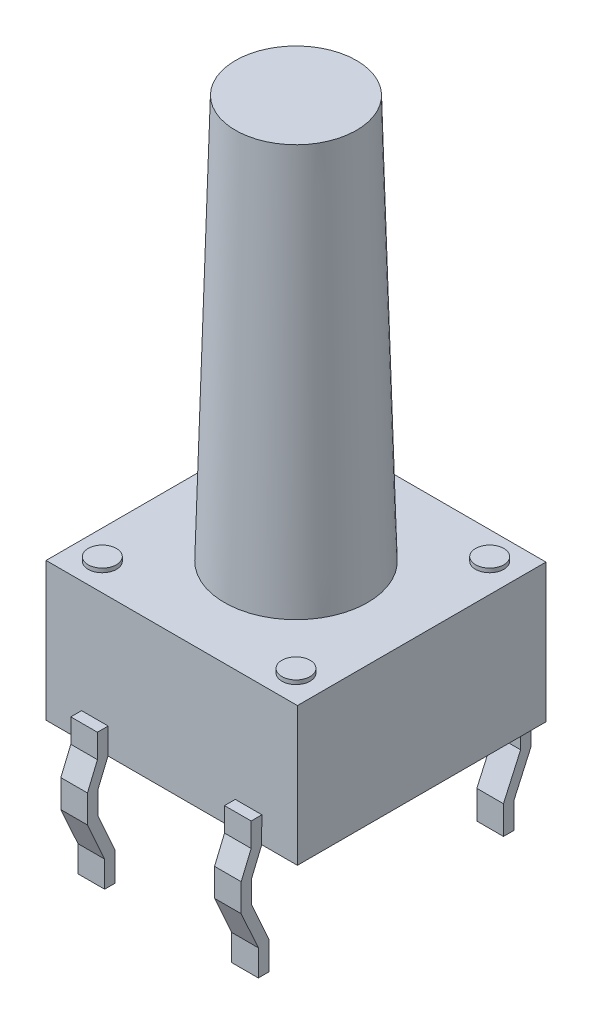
SolidWorks part; units mm, degrees
ref_plane "Plan de face" through (0, 0, 0) normal (0, 0, 1) x (1, 0, 0)
ref_plane "Plan de dessus" through (0, 0, 0) normal (0, 1, 0) x (1, 0, 0)
ref_plane "Plan de droite" through (0, 0, 0) normal (1, 0, 0) x (0, 0, -1)
sketch "Esquisse1" plane through (0, 0, 0) normal (0, 1, 0) x (1, 0, 0)
  line L0 (0, 0) -> (0, 3.08) construction
  line L1 (-3.115, -3.08) -> (3.115, -3.08)
  line L2 (-3.115, -3.08) -> (-3.115, 3.08)
  line L3 (-3.115, 3.08) -> (3.115, 3.08)
  line L4 (3.115, -3.08) -> (3.115, 3.08)
  line L5 (0, 3.08) -> (3.115, 0) construction
  line L6 (3.115, 0) -> (0, 0) construction
  dimension "D1" = 6.23
  dimension "D2" = 6.16
extrude "Extrusion1" add sketch "Esquisse1" along normal blind 3.43
sketch "Esquisse3" plane through (0, 0, 3.08) normal (0, 0, 1) x (1, 0, 0)
  line L0 (0, -1.7296) -> (0, 2.2567) construction
  line L1 (1.575, 0.6459) -> (2.235, 0.6459)
  line L2 (1.575, 0.6459) -> (1.575, 0.3844)
  line L3 (1.575, 0.3844) -> (2.235, 0.3844)
  line L4 (2.235, 0.6459) -> (2.235, 0.3844)
  line L5 (1.905, 2.2567) -> (1.905, -1.7296) construction
  line L6 (1.575, -0.6236) -> (1.575, 1.1812) construction
  line L7 (2.235, -0.9882) -> (2.235, 1.5214) construction
  line L8 (3.2331, 0.3844) -> (1.2877, 0.3844) construction
  line L9 (3.2331, 0.6459) -> (1.2877, 0.6459) construction
  line L10 (3.1577, 0.5144) -> (1.3675, 0.5144) construction
  dimension "D1" = 1.905
  dimension "D2" = 0.33
  dimension "D3" = 0.33
  dimension "D4" = 0.13
ref_plane "Plan1" through (1.575, 0, 0) normal (1, 0, 0) x (0, 0, -1)
sketch "Esquisse4" plane through (1.575, 0, 0) normal (1, 0, 0) x (0, 0, -1)
  line L0 (-2.8776, 0.5029) -> (-3.2037, 0.5029)
  line L2 (-3.2037, 0.5029) -> (-3.2037, 0.0279)
  line L3 (-3.2037, 0.0279) -> (-3.4504, -0.5632)
  line L4 (-3.4504, -0.5632) -> (-3.4504, -1.1911)
  line L5 (-3.4504, -1.1911) -> (-3.0253, -2.1355)
  line L6 (-3.0253, -2.1355) -> (-3.0253, -2.8138)
  line L7 (0, 0.0322) -> (0, -3.2332) construction
  line L8 (-3.125, -1.0945) -> (-3.125, -3.4532) construction
  line L9 (-5.6151, -2.8138) -> (2.1799, -2.8138) construction
  line L10 (-3.6368, 0.1862) -> (-5.7176, 0.1862) construction
  line L11 (-4.0388, -1.8138) -> (2.3927, -1.8138) construction
  dimension "D1" = 3.125
  dimension "D2" = 3
  dimension "D3" = 1
sweep "Balayage1" add profiles "Esquisse3" path "Esquisse4"
mirror "Symétrie1" about plane through (0, 0, 0) normal (1, 0, 0) of "Balayage1"
mirror "Symétrie2" about plane through (0, 0, 0) normal (0, 0, 1) of "Symétrie1", "Balayage1"
sketch "Esquisse5" plane through (0, 3.43, 0) normal (0, 1, 0) x (-1, 0, 0)
  line L0 (-2.4, 2.4) -> (2.4, 2.4) construction
  line L1 (2.4, 2.4) -> (2.4, -2.4) construction
  line L2 (2.4, -2.4) -> (-2.4, -2.4) construction
  line L3 (-2.4, -2.4) -> (-2.4, 2.4) construction
  line L4 (0, 0) -> (-2.4, 0) construction
  line L5 (-2.4, 0) -> (0, 2.4) construction
  line L6 (0, 2.4) -> (0, 0) construction
  circle A0 centre (-2.4, 2.4) radius 0.35
  circle A1 centre (-2.4, -2.4) radius 0.35
  circle A2 centre (2.4, -2.4) radius 0.35
  circle A3 centre (2.4, 2.4) radius 0.35
  dimension "D1" = 0.7
extrude "Extrusion3" add sketch "Esquisse5" along normal blind 0.1
sketch "Esquisse6" plane through (0, 0, 0) normal (1, 0, 0) x (0, 0, -1)
  line L0 (0, -0.9176) -> (0, 15.2088) construction
  line L1 (10.1573, 3.43) -> (-5.1045, 3.43) construction
  line L2 (-1.775, 4.3451) -> (-1.775, 3.0106) construction
  line L3 (-3.6385, 13.43) -> (5.8531, 13.43) construction
  line L4 (-1.5, 15.2088) -> (-1.5, 10.3596) construction
  line L5 (0, 3.43) -> (-1.775, 3.43)
  line L6 (-1.775, 3.43) -> (-1.5, 13.43)
  line L7 (-1.5, 13.43) -> (0, 13.43)
  line L8 (0, 13.43) -> (0, 3.43)
  dimension "D1" = 1.775
  dimension "D2" = 1.5
  dimension "D3" = 10
revolve "Révolution1" add sketch "Esquisse6" angle 360 about L0
